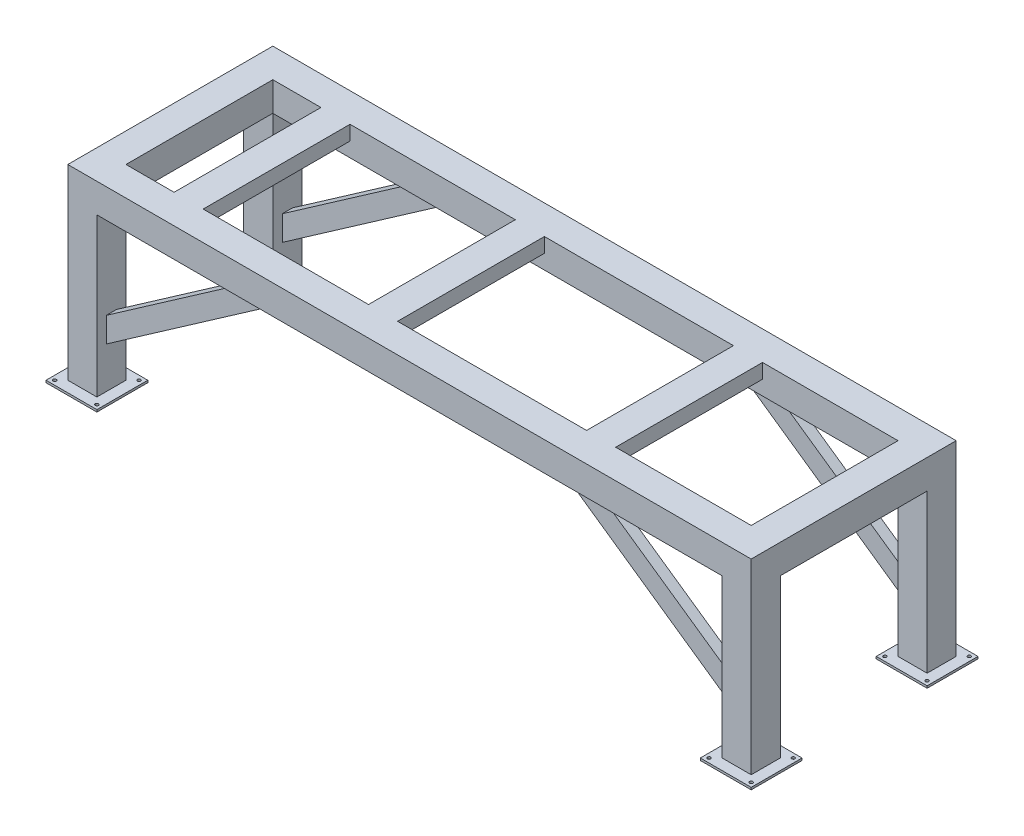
SolidWorks part; units mm, degrees
ref_plane "Front Plane" through (0, 0, 0) normal (0, 0, 1) x (1, 0, 0)
ref_plane "Top Plane" through (0, 0, 0) normal (0, 1, 0) x (1, 0, 0)
ref_plane "Right Plane" through (0, 0, 0) normal (1, 0, 0) x (0, 0, -1)
sketch "Sketch1" plane through (0, 0, 0) normal (0, 1, 0) x (1, 0, 0)
  line L0 (-2150, 505) -> (2150, 505)
  line L1 (-2350, -705) -> (2350, -705)
  line L2 (-2350, -705) -> (-2350, 705)
  line L3 (-2350, 705) -> (2350, 705)
  line L4 (2350, -705) -> (2350, 705)
  line L5 (-2350, -705) -> (2350, 705) construction
  line L6 (-2350, 705) -> (2350, -705) construction
  line L7 (2150, -505) -> (2150, 505)
  line L8 (-2150, -505) -> (2150, -505)
  line L9 (-2150, -505) -> (-2150, 505)
  point P0 (0, 0)
  dimension "D1" = 1410
  dimension "D2" = 4700
  dimension "D3" = 200
extrude "Boss-Extrude1" add sketch "Sketch1" along normal blind 200
sketch "Sketch4" plane through (0, 0, 0) normal (0, 0, 1) x (1, 0, 0)
  line L0 (-2350, 200) -> (2350, 200) construction
  line L2 (1018, 100) -> (1018, 200)
  line L3 (1018, 200) -> (1218, 200)
  line L4 (1218, 100) -> (1218, 200)
  line L8 (2350, 200) -> (2350, 0) construction
  line L9 (1028, 190) -> (1208, 190)
  line L10 (1208, 100) -> (1208, 190)
  line L12 (1028, 100) -> (1028, 190)
  line L13 (1218, 0) -> (1218, 200) construction
  line L14 (1208, 10) -> (1208, 190) construction
  line L15 (1028, 10) -> (1028, 190) construction
  line L16 (1208, 100) -> (1218, 100)
  line L17 (1028, 100) -> (1018, 100)
  line L18 (1018, 0) -> (1018, 200) construction
  line L19 (1018, 0) -> (1218, 0) construction
  line L20 (1028, 10) -> (1208, 10) construction
  dimension "D1" = 200
  dimension "D2" = 1132
  dimension "D4" = 100
  dimension "D3" = 10
extrude "Boss-Extrude3" add sketch "Sketch4" along normal mid plane 1010
pattern_linear "LPattern1" count 2 spacing 2837 along (-1, 0, 0) of "Boss-Extrude3"
ref_plane "Plane1" through (0, 10, 0) normal (0, -1, 0) x (-1, 0, 0)
sketch "Sketch7" plane through (0, 10, 0) normal (0, -1, 0) x (-1, 0, 0)
  line L0 (-2350, 705) -> (2350, 705) construction
  line L1 (2340, 695) -> (-2340, 695)
  line L2 (2340, 695) -> (2340, -695)
  line L3 (2340, -695) -> (-2340, -695)
  line L4 (-2340, 695) -> (-2340, -695)
  line L5 (2350, 705) -> (2350, -705) construction
  line L6 (-2350, -705) -> (-2350, 705) construction
  line L7 (2350, -705) -> (-2350, -705) construction
  line L8 (-2160, 515) -> (-2160, -515)
  line L9 (2160, -515) -> (-2160, -515)
  line L10 (2160, 515) -> (2160, -515)
  line L11 (2160, 515) -> (-2160, 515)
  dimension "D1" = 10
  dimension "D2" = 10
  dimension "D3" = 10
  dimension "D4" = 10
  dimension "D5" = 180
extrude "Cut-Extrude1" cut sketch "Sketch7" against normal blind 180
sketch "Sketch8" plane through (0, 0, 0) normal (0, -1, 0) x (1, 0, 0)
  line L0 (2156, -699) -> (2156, -511)
  line L1 (2350, -705) -> (2150, -705)
  line L2 (2350, -705) -> (2350, -505)
  line L3 (2350, -505) -> (2150, -505)
  line L4 (2150, -705) -> (2150, -505)
  line L5 (2344, -511) -> (2156, -511)
  line L6 (2344, -699) -> (2344, -511)
  line L7 (2344, -699) -> (2156, -699)
  dimension "D1" = 6
extrude "Boss-Extrude5" add sketch "Sketch8" along normal blind 1085
sketch "Sketch9" plane through (0, -1085, 0) normal (0, -1, 0) x (1, 0, 0)
  line L0 (2350, -605) -> (2150, -605) construction
  line L1 (2350, -705) -> (2350, -505) construction
  line L2 (2150, -505) -> (2150, -705) construction
  line L4 (2425, -780) -> (2075, -780)
  line L5 (2425, -780) -> (2425, -430)
  line L6 (2425, -430) -> (2075, -430)
  line L7 (2075, -780) -> (2075, -430)
  line L8 (2425, -780) -> (2075, -430) construction
  line L9 (2425, -430) -> (2075, -780) construction
  line L10 (2395, -460) -> (2105, -460) construction
  line L11 (2395, -460) -> (2395, -750) construction
  line L12 (2395, -750) -> (2105, -750) construction
  line L13 (2105, -460) -> (2105, -750) construction
  line L14 (2395, -460) -> (2105, -750) construction
  line L15 (2395, -750) -> (2105, -460) construction
  circle A0 centre (2105, -460) radius 11
  circle A1 centre (2395, -460) radius 11
  circle A2 centre (2395, -750) radius 11
  circle A3 centre (2105, -750) radius 11
  point P6 (2250, -605)
  point P11 (2250, -605)
  dimension "D3" = 22
  dimension "D1" = 350
  dimension "D2" = 290
extrude "Boss-Extrude6" add sketch "Sketch9" along normal blind 15
pattern_linear "LPattern2" count 2 spacing 4500 along (-1, 0, 0) count 2 spacing 1210 along (0, 0, 1) of "Boss-Extrude5", "Boss-Extrude6"
ref_plane "Plane2" through (0, 0, -605) normal (0, 0, -1) x (-1, 0, 0)
sketch "Sketch10" plane through (0, 0, -605) normal (0, 0, -1) x (-1, 0, 0)
  line L0 (-1244.8201, 0) -> (-2150, -630.9744)
  line L1 (-2150, 0) -> (2150, 0) construction
  line L2 (-2150, -1085) -> (-2150, 0) construction
  line L3 (-2150, -630.9744) -> (-2150, -801.6313)
  line L4 (-2150, -801.6313) -> (-1000, 0)
  line L5 (-1000, 0) -> (-1244.8201, 0)
  point P7 (-1575, -400.8157)
  point P9 (-2150, -622.2011)
  dimension "D1" = 140
  dimension "D2" = 1150
extrude "Boss-Extrude7" add sketch "Sketch10" along normal mid plane 70
mirror "Mirror4" about plane through (0, 0, 0) normal (0, 0, 1) of "Boss-Extrude7"
pattern_linear "LPattern3" count 2 spacing 1500 along (-1, 0, 0) of "Boss-Extrude3"
mirror "Mirror5" about plane through (0, 0, 0) normal (1, 0, 0) of "Mirror4", "Boss-Extrude7"
